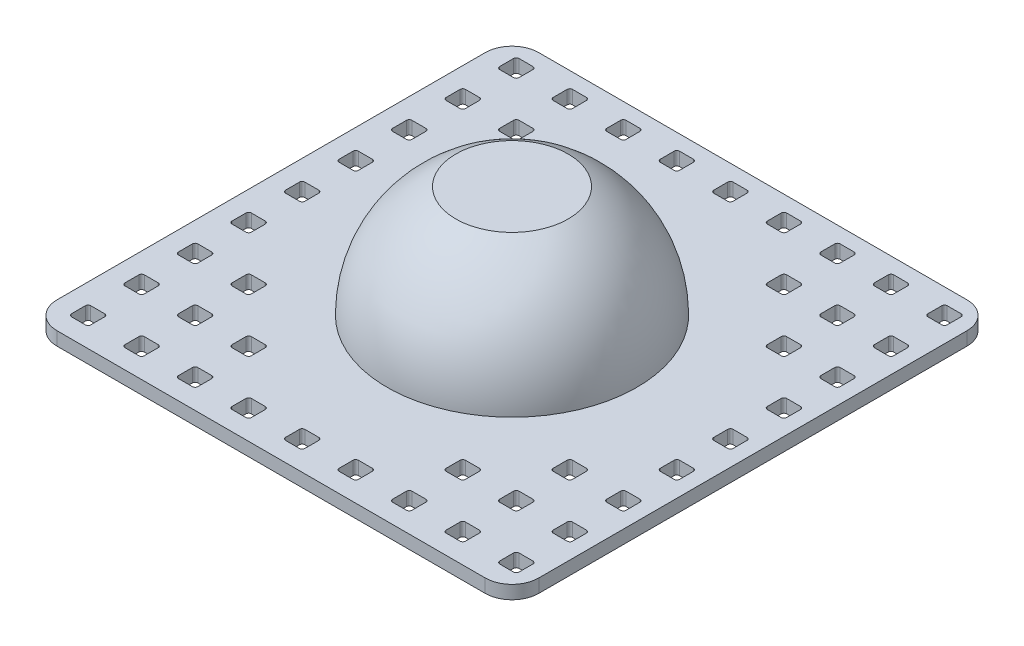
SolidWorks part; units mm, degrees
ref_plane "Front Plane" through (0, 0, 0) normal (0, 0, 1) x (1, 0, 0)
ref_plane "Top Plane" through (0, 0, 0) normal (0, 1, 0) x (1, 0, 0)
ref_plane "Right Plane" through (0, 0, 0) normal (1, 0, 0) x (0, 0, -1)
sketch "Sketch1" plane through (0, 0, 0) normal (0, 1, 0) x (1, 0, 0)
  line L0 (0, 29.6333) -> (0, -29.6333)
  arc A0 (0, -29.6333) -> (0, 29.6333) centre (0, 0) ccw
  dimension "D1" = 59.2667
revolve "Revolve3" add sketch "Sketch1" angle 360 about L0
sketch "Sketch2" plane through (0, 0, 0) normal (0, 1, 0) x (1, 0, 0)
  line L0 (-29.6333, -29.6333) -> (29.6333, -29.6333)
  line L1 (-29.6333, -29.6333) -> (-29.6333, 29.6333)
  line L2 (29.6333, -29.6333) -> (29.6333, 29.6333)
  line L3 (-29.6333, 29.6333) -> (29.6333, 29.6333)
  line L4 (-29.6333, -29.6333) -> (29.6333, 29.6333) construction
  line L5 (29.6333, -29.6333) -> (-29.6333, 29.6333) construction
  circle A0 centre (0, 0) radius 29.6333 construction
  point P1 (0, 0)
extrude "Cut-Extrude1" cut sketch "Sketch2" against normal through all
sketch "Sketch3" plane through (0, 0, 0) normal (0, 1, 0) x (1, 0, 0)
  line L1 (-57.15, 57.15) -> (57.15, 57.15)
  line L2 (-57.15, 57.15) -> (-57.15, -57.15)
  line L3 (-57.15, -57.15) -> (57.15, -57.15)
  line L4 (57.15, 57.15) -> (57.15, -57.15)
  line L5 (-57.15, 57.15) -> (57.15, -57.15) construction
  line L6 (-57.15, -57.15) -> (57.15, 57.15) construction
  point P0 (0, 0)
  dimension "D1" = 114.3
extrude "Boss-Extrude1" add sketch "Sketch3" against normal blind 3.175
sketch "Sketch4"
  dimension "D4" = 0.635
  dimension "D1" = 4.572
  dimension "D2" = 4.572
  dimension "D3" = 4.572
extrude "Cut-Extrude2" cut sketch "Sketch4" against normal through all
sketch "Sketch6" plane through (0, -3.175, 0) normal (0, -1, 0) x (-1, 0, 0)
  line L0 (0, 23.2833) -> (0, -23.2833)
  arc A0 (0, 23.2833) -> (0, -23.2833) centre (0, 0) ccw
  point P4 (0, 0)
  dimension "D1" = 46.5667
revolve "Cut-Revolve5" cut sketch "Sketch6" angle 360 about L0
fillet "Fillet1" radius 6.35 4 edges at (57.15, -1.5875, 57.15) (57.15, -1.5875, -57.15) (-57.15, -1.5875, -57.15) (-57.15, -1.5875, 57.15)
ref_plane "Plane1" through (0, 29.6333, 0) normal (0, 1, 0) x (1, 0, 0)
sketch "Sketch7" plane through (0, 29.6333, 0) normal (0, 1, 0) x (1, 0, 0)
  circle A0 centre (0, 0) radius 29.6333 construction
  circle A1 centre (0, 0) radius 29.6333
extrude "Cut-Extrude3" cut sketch "Sketch7" against normal blind 3.175
